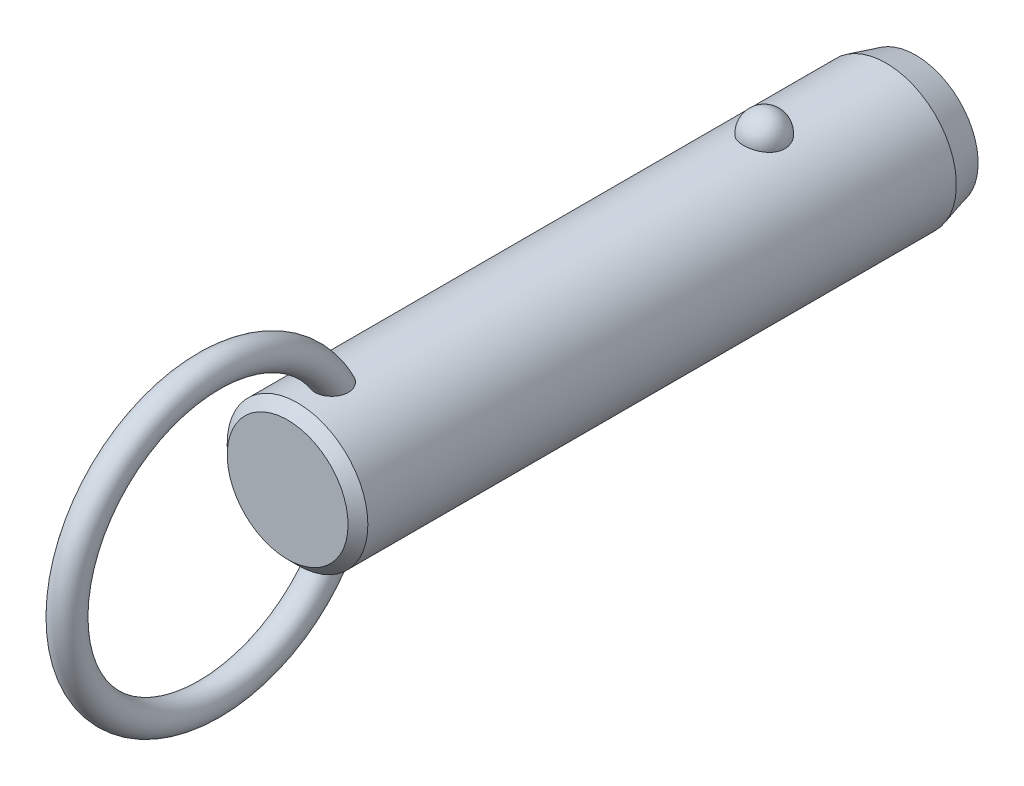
SolidWorks part; units mm, degrees
ref_plane "Front Plane" through (0, 0, 0) normal (0, 0, 1) x (1, 0, 0)
ref_plane "Top Plane" through (0, 0, 0) normal (0, 1, 0) x (1, 0, 0)
ref_plane "Right Plane" through (0, 0, 0) normal (1, 0, 0) x (0, 0, -1)
sketch "Sketch2" plane through (0, 0, 0) normal (0, 0, 1) x (1, 0, 0)
  circle A0 centre (0, 0) radius 7.1
  point P3 (0, 7.1)
  dimension "D1" = 14.2
extrude "Boss-Extrude1" add sketch "Sketch2" along normal blind 38.1
sketch "Sketch3" plane through (0, 0, 0) normal (0, 0, -1) x (-1, 0, 0)
  circle A0 centre (0, 0) radius 7.1
  dimension "D1" = 14.2
extrude "Boss-Extrude2" add sketch "Sketch3" along normal blind 17.4
chamfer "Chamfer1" distance 3 angle 15 1 edges at (-7.1, 0, -17.4)
sketch "Sketch12" plane through (0, 0, 0) normal (1, 0, 0) x (0, 0, -1)
  line L0 (-38.1, 7.1) -> (-38.1, -7.1) construction
  point P0 (-38.1, 0)
sketch "Sketch13" plane through (0, 0, 0) normal (1, 0, 0) x (0, 0, -1)
  circle A0 centre (-53.95, 0) radius 15.85
  point P2 (-38.1, 0)
  dimension "D1" = 31.7
sketch "Sketch14" plane through (0, 0, 0) normal (0, 1, 0) x (1, 0, 0)
  circle A0 centre (0, -39.6) radius 1.5
  point P2 (0, -38.1)
  dimension "D1" = 3
sweep "Sweep1" add profiles "Sketch14" path "Sketch13"
sketch "Sketch15" plane through (0, 0, 38.1) normal (0, 0, 1) x (1, 0, 0)
  circle A0 centre (0, 0) radius 7.1
  dimension "D1" = 14.2
extrude "Boss-Extrude3" add sketch "Sketch15" along normal blind 7.92
chamfer "Chamfer2" distance 1 angle 45 1 edges at (7.1, 0, 46.02)
sketch "Sketch18" plane through (0, 0, 0) normal (1, 0, 0) x (0, 0, -1)
  line L0 (14.4, 7.1) -> (-39.7792, 7.1) construction
  line L1 (2.1, 9.2) -> (2.1, 5)
  line L2 (-39.7792, -7.1) -> (14.4, -7.1) construction
  arc A0 (2.1, 9.2) -> (2.1, 5) centre (2.1, 7.1) ccw
  point P4 (0, 7.1)
  dimension "D1" = 16.3
revolve "Revolve1" add sketch "Sketch18" angle 360 about L1
